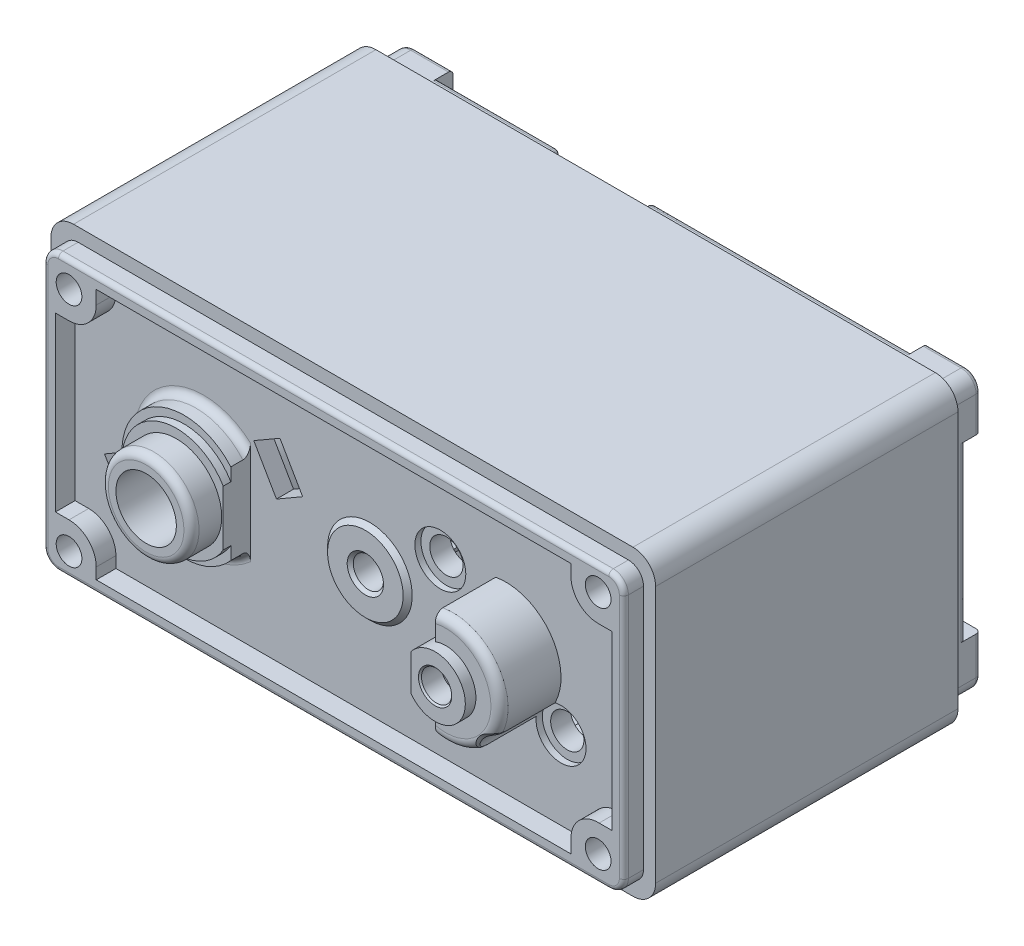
SolidWorks part; units mm, degrees
ref_plane "Front Plane" through (0, 0, 0) normal (0, 0, 1) x (1, 0, 0)
ref_plane "Top Plane" through (0, 0, 0) normal (0, 1, 0) x (1, 0, 0)
ref_plane "Right Plane" through (0, 0, 0) normal (1, 0, 0) x (0, 0, -1)
sketch "Sketch1" plane through (0, 0, 0) normal (0, 0, 1) x (1, 0, 0)
  line L0 (20, 10.083) -> (-20, 10.083)
  line L1 (-20, 10.083) -> (-20, -9.917)
  line L2 (20, -9.917) -> (20, 10.083)
  line L3 (20, -9.917) -> (-20, -9.917)
  line L4 (0, 10.083) -> (0, -13.0619) construction
  dimension "D1" = 40
  dimension "D2" = 20
  dimension "D3" = 10.083
extrude "Extrude1" add sketch "Sketch1" along normal blind 20
sketch "Sketch2" plane through (0, 0, 0) normal (0, 0, -1) x (-1, 0, 0)
  line L0 (-20, 10.083) -> (20, 10.083) construction
  line L1 (20, -9.917) -> (-20, -9.917) construction
  line L5 (-19.2, 9.2) -> (19.2, 9.2)
  line L6 (19.2, 9.2) -> (19.2, -9.037)
  line L8 (19.2, -9.037) -> (-19.2, -9.037)
  line L9 (-19.2, -9.037) -> (-19.2, 9.2)
  point P10 (0, 0)
  dimension "D1" = 19.2
  dimension "D2" = 0.883
  dimension "D3" = 19.2
  dimension "D4" = 0.88
extrude "Cut-Extrude1" cut sketch "Sketch2" against normal blind 18.87
fillet "Fillet1" radius 1 4 edges at (19.2, 9.2, 9.435) (19.2, -9.037, 9.435) (-19.2, -9.037, 9.435) (-19.2, 9.2, 9.435)
sketch "Sketch4" plane through (0, 0, 0) normal (0, 0, -1) x (-1, 0, 0)
  line L0 (19.2, 2.35) -> (18.4, 2.35)
  line L1 (19.2, -2.35) -> (18.4, -2.35)
  line L2 (19.2, -5.7) -> (18.4, -5.7)
  line L3 (15.7, -9.037) -> (15.7, -8.237)
  line L4 (7.5755, -9.037) -> (7.5755, -8.237)
  line L5 (0, 0) -> (0, 15.292) construction
  line L6 (19.2, 5.7) -> (18.4, 5.7)
  line L7 (15.7, 8.4) -> (15.7, 9.2)
  line L8 (-18.2, -9.037) -> (18.2, -9.037) construction
  line L31 (-15.7, 8.4) -> (1.6, 8.4)
  line L32 (-15.7, 9.2) -> (1.6, 9.2)
  line L33 (7.5755, 9.2) -> (15.7, 9.2)
  line L34 (7.5755, 8.4) -> (15.7, 8.4)
  line L35 (18.4, 5.7) -> (18.4, 2.35)
  line L36 (19.2, 5.7) -> (19.2, 2.35)
  line L37 (18.4, -2.35) -> (18.4, -5.7)
  line L38 (19.2, -2.35) -> (19.2, -5.7)
  line L39 (15.7, -9.037) -> (7.5755, -9.037)
  line L40 (15.7, -8.237) -> (7.5755, -8.237)
  line L41 (1.6, -9.037) -> (-15.7, -9.037)
  line L42 (1.6, -8.237) -> (-15.7, -8.237)
  line L43 (-18.4, -5.537) -> (-18.4, 5.863)
  line L44 (-19.2, -5.537) -> (-19.2, 5.863)
  line L45 (1.6, -9.037) -> (1.6, -8.237)
  line L46 (-15.7, -9.037) -> (-15.7, -8.237)
  line L47 (-18.4, -5.537) -> (-19.2, -5.537)
  line L48 (-18.4, 5.863) -> (-19.2, 5.863)
  line L49 (-15.7, 8.4) -> (-15.7, 9.2)
  line L50 (1.6, 8.4) -> (1.6, 9.2)
  line L51 (7.5755, 8.4) -> (7.5755, 9.2)
  point P8 (0, 0)
  dimension "D3" = 8.4
  dimension "D4" = 9.2
  dimension "D5" = 8.4
  dimension "D6" = 9.2
  dimension "D7" = 18.4
  dimension "D8" = 19.2
  dimension "D11" = 0.8
  dimension "D12" = 18.4
  dimension "D13" = 0.8
  dimension "D14" = 18.4
  dimension "D15" = 2.7
  dimension "D16" = 2.7
  dimension "D21" = 11.4
  dimension "D22" = 2.7
  dimension "D23" = 5.9755
  dimension "D24" = 17.3
  dimension "D25" = 8.1245
  dimension "D26" = 8.1245
  dimension "D27" = 3.35
  dimension "D28" = 3.35
  dimension "D29" = 4.7
  dimension "D32" = 17.3
  dimension "D33" = 2.7
ref_plane "Plane1" through (0, 0, 0) normal (0, 0, -1) x (-1, 0, 0)
extrude "Extrude3" add sketch "Sketch4" along normal blind 1.3
sketch "Sketch5" plane through (0, 0, -1.3) normal (0, 0, -1) x (-1, 0, 0)
  line L0 (-15.7, 8.4) -> (-15.7, 9.2) construction
  line L1 (1.6, 8.4) -> (1.6, 9.2) construction
  line L2 (-15.7, 9.2) -> (1.6, 9.2) construction
  line L3 (-15.7, 8.4) -> (1.6, 8.4) construction
  line L4 (-15.7, 8.4) -> (-15.7, 9.2)
  line L5 (1.6, 8.4) -> (1.6, 9.2)
  line L6 (-15.7, 9.2) -> (1.6, 9.2)
  line L7 (-15.7, 8.4) -> (1.6, 8.4)
  line L8 (7.5755, -9.037) -> (15.7, -9.037) construction
  line L9 (15.7, -9.037) -> (15.7, -8.237) construction
  line L10 (15.7, -8.237) -> (7.5755, -8.237) construction
  line L11 (7.5755, -9.037) -> (7.5755, -8.237) construction
  line L12 (1.6, -9.037) -> (1.6, -8.237) construction
  line L13 (-15.7, -9.037) -> (-15.7, -8.237) construction
  line L14 (1.6, -8.237) -> (-15.7, -8.237) construction
  line L15 (1.6, -9.037) -> (-15.7, -9.037) construction
  line L16 (7.5755, -9.037) -> (15.7, -9.037)
  line L17 (15.7, -9.037) -> (15.7, -8.237)
  line L18 (15.7, -8.237) -> (7.5755, -8.237)
  line L19 (7.5755, -9.037) -> (7.5755, -8.237)
  line L20 (1.6, -9.037) -> (1.6, -8.237)
  line L21 (-15.7, -9.037) -> (-15.7, -8.237)
  line L22 (1.6, -8.237) -> (-15.7, -8.237)
  line L23 (1.6, -9.037) -> (-15.7, -9.037)
  line L24 (-18.4, 5.863) -> (-19.2, 5.863) construction
  line L25 (-18.4, -5.537) -> (-19.2, -5.537) construction
  line L26 (-19.2, -5.537) -> (-19.2, 5.863) construction
  line L27 (-18.4, -5.537) -> (-18.4, 5.863) construction
  line L28 (-18.4, 5.863) -> (-19.2, 5.863)
  line L29 (-18.4, -5.537) -> (-19.2, -5.537)
  line L30 (-19.2, -5.537) -> (-19.2, 5.863)
  line L31 (-18.4, -5.537) -> (-18.4, 5.863)
  line L33 (19.2, 2.35) -> (19.2, 5.7) construction
  line L34 (19.2, 2.35) -> (18.4, 2.35) construction
  line L35 (18.4, 5.7) -> (18.4, 2.35) construction
  line L36 (19.2, -2.35) -> (18.4, -2.35) construction
  line L37 (19.2, -5.7) -> (18.4, -5.7) construction
  line L38 (19.2, -5.7) -> (19.2, -2.35) construction
  line L39 (18.4, -2.35) -> (18.4, -5.7) construction
  line L40 (18.4, 5.7) -> (19.2, 5.7)
  line L41 (19.2, 2.35) -> (19.2, 5.7)
  line L42 (19.2, 2.35) -> (18.4, 2.35)
  line L43 (18.4, 5.7) -> (18.4, 2.35)
  line L44 (19.2, -2.35) -> (18.4, -2.35)
  line L45 (19.2, -5.7) -> (18.4, -5.7)
  line L46 (19.2, -5.7) -> (19.2, -2.35)
  line L47 (18.4, -2.35) -> (18.4, -5.7)
  line L48 (15.7, 8.4) -> (15.7, 9.2) construction
  line L49 (7.5755, 8.4) -> (7.5755, 9.2) construction
  line L50 (15.7, 9.2) -> (7.5755, 9.2) construction
  line L51 (7.5755, 8.4) -> (15.7, 8.4) construction
  line L52 (15.7, 8.4) -> (15.7, 9.2)
  line L53 (7.5755, 8.4) -> (7.5755, 9.2)
  line L54 (15.7, 9.2) -> (7.5755, 9.2)
  line L55 (7.5755, 8.4) -> (15.7, 8.4)
extrude "Extrude4" add sketch "Sketch5" against normal up to vertex
sketch "Sketch6" plane through (0, 0, 0) normal (0, 0, -1) x (-1, 0, 0)
  line L0 (0, 0) -> (-27.3458, 0) construction
  line L1 (-19.2, -5.537) -> (-18.9613, -5.537)
  line L2 (-15.7, -7.336) -> (-15.7, -8.736)
  line L3 (-15.7, -8.736) -> (-15.7, -9.037)
  line L4 (-18.2, -9.037) -> (-15.7, -9.037) construction
  line L5 (-18.9613, -5.537) -> (-17.5613, -5.537)
  line L6 (-19.2, -5.537) -> (-19.2, -8.037) construction
  line L8 (0, 0) -> (0, 14.9831) construction
  line L9 (19.2, -5.7) -> (18.9, -5.7)
  line L10 (19.2, -5.7) -> (19.2, -8.037)
  line L11 (18.2, -9.037) -> (15.7, -9.037)
  line L12 (15.7, -9.037) -> (18.2, -9.037) construction
  line L13 (18.4, -5.7) -> (19.2, -5.7) construction
  line L14 (15.7, -9.037) -> (15.7, -8.237) construction
  line L15 (19.2, -8.037) -> (19.2, -5.7) construction
  line L16 (19.2, 5.7) -> (18.4, 5.7) construction
  line L17 (15.7, -8.9) -> (15.7, -9.037)
  line L18 (15.7, -7.5) -> (15.7, -8.9)
  line L19 (18.9, -5.7) -> (17.5, -5.7)
  line L20 (18.9, 5.7) -> (17.5, 5.7)
  line L21 (15.7, 7.5) -> (15.7, 8.9)
  line L22 (15.7, 8.9) -> (15.7, 9.2)
  line L23 (18.2, 9.2) -> (15.7, 9.2)
  line L24 (19.2, 5.7) -> (19.2, 8.2)
  line L25 (19.2, 5.7) -> (18.9, 5.7)
  line L26 (-18.4, 5.863) -> (-19.2, 5.863) construction
  line L27 (-15.7, 9.2) -> (-18.2, 9.2) construction
  line L28 (18.2, 9.2) -> (15.7, 9.2) construction
  line L29 (15.7, 8.4) -> (15.7, 9.2) construction
  line L30 (19.2, 5.7) -> (19.2, 8.2) construction
  line L33 (-18.2, -9.037) -> (-15.7, -9.037)
  line L34 (-19.2, -5.537) -> (-19.2, -8.037)
  line L44 (-19.2, 5.863) -> (-18.9, 5.863)
  line L45 (-19.2, 5.863) -> (-19.2, 8.2)
  line L46 (-18.2, 9.2) -> (-15.7, 9.2)
  line L47 (-15.7, 9.063) -> (-15.7, 9.2)
  line L48 (-15.7, 7.663) -> (-15.7, 9.063)
  line L49 (-18.9, 5.863) -> (-17.5, 5.863)
  arc A0 (-15.7, -7.336) -> (-17.5613, -5.537) centre (-17.5, -7.336) ccw
  arc A2 (-19.2, -8.037) -> (-18.2, -9.037) centre (-18.2, -8.037) ccw construction
  arc A5 (18.2, -9.037) -> (19.2, -8.037) centre (18.2, -8.037) ccw
  arc A6 (17.5, -5.7) -> (15.7, -7.5) centre (17.5, -7.5) ccw
  arc A9 (-18.2, 9.2) -> (-19.2, 8.2) centre (-18.2, 8.2) ccw
  arc A10 (-17.5, 5.863) -> (-15.7, 7.663) centre (-17.5, 7.663) ccw
  arc A11 (17.5, 5.7) -> (15.7, 7.5) centre (17.5, 7.5) cw
  arc A12 (18.2, 9.2) -> (19.2, 8.2) centre (18.2, 8.2) cw
  arc A13 (-19.2, -8.037) -> (-18.2, -9.037) centre (-18.2, -8.037) ccw
  point P26 (0, 0)
  dimension "D7" = 1
  dimension "D8" = 1.8
  dimension "D11" = 2.5
  dimension "D14" = 0.137
  dimension "D3" = 1.8
  dimension "D2" = 1.4
  dimension "D9" = 1.8
  dimension "D13" = 1
  dimension "D17" = 1.8
  dimension "D18" = 1
  dimension "D1" = 17.5
  dimension "D4" = 2.5
  dimension "D5" = 0.301
  dimension "D6" = 1.4
  dimension "D10" = 1.4
  dimension "D12" = 0.3
  dimension "D15" = 17.5
  dimension "D16" = 8.037
  dimension "D19" = 2.5
  dimension "D20" = 1.4
  dimension "D21" = 0.3
  dimension "D22" = 0.3
  dimension "D23" = 17.5
  dimension "D24" = 8.2
extrude "Extrude10" add sketch "Sketch6" against normal up to vertex
ref_plane "Plane2" through (0, 0, 0) normal (1, 0, 0) x (0, 0, -1)
ref_plane "Plane3" through (0, 0.083, 0) normal (0, -1, 0) x (1, 0, 0)
ref_plane "Plane4" through (0, 0, -0.5) normal (0, 0, -1) x (-1, 0, 0)
sketch "Sketch8" plane through (0, 0, -0.5) normal (0, 0, -1) x (-1, 0, 0)
  line L0 (7.5755, 8.4) -> (7.5755, 9.2) construction
  line L1 (1.6, 9.2) -> (7.5755, 9.2)
  line L2 (1.6, 9.2) -> (1.6, 8.7)
  line L3 (1.6, 8.7) -> (7.5755, 8.7)
  line L4 (7.5755, 9.2) -> (7.5755, 8.7)
  dimension "D1" = 0.5
extrude "Extrude12" add sketch "Sketch8" against normal up to vertex
sketch "Sketch9" plane through (0, 8.7, 0) normal (0, -1, 0) x (1, 0, 0)
  line L1 (-1.6, 8.78) -> (-7.5755, 8.78)
  line L2 (-1.6, 8.78) -> (-1.6, 18.87)
  line L3 (-1.6, 18.87) -> (-7.5755, 18.87)
  line L4 (-7.5755, 8.78) -> (-7.5755, 18.87)
  line L5 (-1.6, 18.87) -> (-7.5755, 18.87) construction
  line L6 (-7.5755, 18.87) -> (-7.5755, -0.5) construction
  line L7 (-1.6, 18.87) -> (-1.6, -0.5) construction
  dimension "D1" = 10.09
extrude "Extrude13" add sketch "Sketch9" along normal up to vertex
sketch "Sketch10" plane through (0, 0, -0.5) normal (0, 0, -1) x (-1, 0, 0)
  line L0 (1.6, -9.037) -> (7.5755, -9.037) construction
  line L1 (7.5755, -9.037) -> (1.6, -9.037)
  line L2 (7.5755, -9.037) -> (7.5755, -8.537)
  line L3 (7.5755, -8.537) -> (1.6, -8.537)
  line L4 (1.6, -9.037) -> (1.6, -8.537)
  line L5 (1.6, -9.037) -> (1.6, -8.237) construction
  line L6 (7.5755, -9.037) -> (7.5755, -8.237) construction
  dimension "D1" = 0.5
extrude "Extrude14" add sketch "Sketch10" against normal up to vertex
mirror "Mirror10" about plane through (0, 0.083, 0) normal (0, -1, 0) of "Extrude13"
sketch "Sketch12" plane through (0, 0, 0) normal (0, 0, -1) x (-1, 0, 0)
  line L0 (-15.7, -9.037) -> (-15.7, -8.237) construction
  line L1 (-15.7, -8.237) -> (-15.7, -7.336) construction
  line L2 (-18.4, -5.537) -> (-19.2, -5.537) construction
  line L3 (-17.5613, -5.537) -> (-18.4, -5.537) construction
  line L4 (-15.7, -9.037) -> (-15.7, -8.237)
  line L5 (-15.7, -8.237) -> (-15.7, -7.336)
  line L6 (-18.4, -5.537) -> (-19.2, -5.537)
  line L7 (-17.5613, -5.537) -> (-18.4, -5.537)
  line L8 (-15.7, -9.037) -> (-19.2, -9.037)
  line L9 (-19.2, -9.037) -> (-19.2, -5.537)
  line L10 (-19.2, 5.863) -> (-18.4, 5.863) construction
  line L11 (-18.4, 5.863) -> (-17.5, 5.863) construction
  line L12 (-15.7, 8.4) -> (-15.7, 9.2) construction
  line L13 (-15.7, 7.663) -> (-15.7, 8.4) construction
  line L14 (-19.2, 5.863) -> (-18.4, 5.863)
  line L15 (-18.4, 5.863) -> (-17.5, 5.863)
  line L16 (-15.7, 8.4) -> (-15.7, 9.2)
  line L17 (-15.7, 7.663) -> (-15.7, 8.4)
  line L18 (-15.7, 9.2) -> (-19.2, 9.2)
  line L19 (-19.2, 9.2) -> (-19.2, 5.863)
  line L20 (19.2, -5.7) -> (18.4, -5.7) construction
  line L21 (15.7, -9.037) -> (15.7, -8.237) construction
  line L22 (15.7, -7.5) -> (15.7, -8.237) construction
  line L23 (18.4, -5.7) -> (17.5, -5.7) construction
  line L24 (19.2, -5.7) -> (18.4, -5.7)
  line L25 (15.7, -9.037) -> (15.7, -8.237)
  line L26 (15.7, -7.5) -> (15.7, -8.237)
  line L27 (18.4, -5.7) -> (17.5, -5.7)
  line L28 (19.2, -5.7) -> (19.2, -9.037)
  line L29 (19.2, -9.037) -> (15.7, -9.037)
  line L30 (18.4, 5.7) -> (19.2, 5.7) construction
  line L31 (15.7, 8.4) -> (15.7, 9.2) construction
  line L32 (15.7, 8.4) -> (15.7, 7.5) construction
  line L33 (17.5, 5.7) -> (18.4, 5.7) construction
  line L34 (18.4, 5.7) -> (19.2, 5.7)
  line L35 (15.7, 8.4) -> (15.7, 9.2)
  line L36 (15.7, 8.4) -> (15.7, 7.5)
  line L37 (17.5, 5.7) -> (18.4, 5.7)
  line L38 (19.2, 5.7) -> (19.2, 9.2)
  line L39 (19.2, 9.2) -> (15.7, 9.2)
  arc A0 (-15.7, -7.336) -> (-17.5613, -5.537) centre (-17.5, -7.336) ccw construction
  arc A1 (-15.7, -7.336) -> (-17.5613, -5.537) centre (-17.5, -7.336) ccw
  arc A2 (-17.5, 5.863) -> (-15.7, 7.663) centre (-17.5, 7.663) ccw construction
  arc A3 (-17.5, 5.863) -> (-15.7, 7.663) centre (-17.5, 7.663) ccw
  arc A4 (17.5, -5.7) -> (15.7, -7.5) centre (17.5, -7.5) ccw construction
  arc A5 (17.5, -5.7) -> (15.7, -7.5) centre (17.5, -7.5) ccw
  arc A6 (15.7, 7.5) -> (17.5, 5.7) centre (17.5, 7.5) ccw construction
  arc A7 (15.7, 7.5) -> (17.5, 5.7) centre (17.5, 7.5) ccw
extrude "Extrude16" add sketch "Sketch12" along normal blind 2.3
sketch "Sketch13" plane through (0, 0, -2.3) normal (0, 0, -1) x (-1, 0, 0)
  circle A0 centre (-17.5, -7.336) radius 0.85
  arc A1 (-15.7, -7.336) -> (-17.5613, -5.537) centre (-17.5, -7.336) ccw construction
  circle A2 centre (-17.5, 7.663) radius 0.85
  arc A3 (-17.5, 5.863) -> (-15.7, 7.663) centre (-17.5, 7.663) ccw construction
  circle A4 centre (17.5, 7.5) radius 0.85
  circle A5 centre (17.5, -7.5) radius 0.85
  arc A6 (15.7, 7.5) -> (17.5, 5.7) centre (17.5, 7.5) ccw construction
  arc A7 (17.5, -5.7) -> (15.7, -7.5) centre (17.5, -7.5) ccw construction
  dimension "D1" = 1.7
extrude "Cut-Extrude2" cut sketch "Sketch13" against normal up to next
sketch "Sketch14" plane through (0, 0, 20) normal (0, 0, -1) x (-1, 0, 0)
  line L0 (15.7, -8.237) -> (7.5755, -8.237) construction
  line L1 (18.4, -2.35) -> (18.4, -5.7) construction
  line L2 (18.4, 5.7) -> (18.4, 2.35) construction
  line L3 (7.5755, 8.4) -> (15.7, 8.4) construction
  line L4 (-15.7, 8.4) -> (1.6, 8.4) construction
  line L5 (-18.4, -5.537) -> (-18.4, 5.863) construction
  line L6 (1.6, -8.237) -> (-15.7, -8.237) construction
  line L7 (-15.7, -9.037) -> (-15.7, -7.336) construction
  line L8 (-17.5613, -5.537) -> (-19.2, -5.537) construction
  line L9 (-19.2, -9.037) -> (-19.2, 9.2) construction
  line L10 (19.2, -5.7) -> (17.5, -5.7) construction
  line L11 (15.7, -7.5) -> (15.7, -9.037) construction
  line L12 (-19.2, -9.037) -> (19.2, -9.037) construction
  line L13 (19.2, -9.037) -> (19.2, -5.7) construction
  line L16 (19.2, 2.35) -> (19.2, 9.2) construction
  line L17 (17.5, 5.7) -> (19.2, 5.7) construction
  line L18 (15.7, 9.2) -> (15.7, 7.5) construction
  line L19 (19.2, 9.2) -> (15.7, 9.2) construction
  line L20 (19.2, 5.7) -> (19.2, 9.2) construction
  line L21 (19.2, 9.2) -> (-19.2, 9.2) construction
  line L22 (-15.7, 9.2) -> (-19.2, 9.2) construction
  line L23 (15.7, -8.237) -> (7.5755, -8.237)
  line L24 (18.4, -2.35) -> (18.4, -5.7)
  line L25 (18.4, 5.7) -> (18.4, 2.35)
  line L26 (7.5755, 8.4) -> (15.7, 8.4)
  line L27 (-15.7, 8.4) -> (1.6, 8.4)
  line L28 (-18.4, -5.537) -> (-18.4, 5.863)
  line L29 (1.6, -8.237) -> (-15.7, -8.237)
  line L30 (-15.7, -9.037) -> (-15.7, -7.336)
  line L31 (-17.5613, -5.537) -> (-19.2, -5.537)
  line L32 (-19.2, -9.037) -> (-19.2, 9.2)
  line L33 (19.2, -5.7) -> (17.5, -5.7)
  line L34 (15.7, -7.5) -> (15.7, -9.037)
  line L35 (-19.2, -9.037) -> (19.2, -9.037)
  line L36 (19.2, -9.037) -> (19.2, -5.7)
  line L37 (19.2, 2.35) -> (19.2, -5.7)
  line L38 (18.4, -2.35) -> (18.4, 2.35)
  line L39 (19.2, 2.35) -> (19.2, 9.2)
  line L40 (17.5, 5.7) -> (19.2, 5.7)
  line L41 (15.7, 9.2) -> (15.7, 7.5)
  line L42 (19.2, 9.2) -> (15.7, 9.2)
  line L43 (19.2, 5.7) -> (19.2, 9.2)
  line L44 (19.2, 9.2) -> (-19.2, 9.2)
  line L45 (-15.7, 9.2) -> (-19.2, 9.2)
  line L46 (-15.7, 7.663) -> (-15.7, 9.2) construction
  line L47 (-19.2, 5.863) -> (-17.5, 5.863) construction
  line L48 (-15.7, 7.663) -> (-15.7, 9.2)
  line L49 (-19.2, 5.863) -> (-17.5, 5.863)
  line L50 (7.5755, 8.4) -> (1.6, 8.4)
  line L51 (7.5755, -8.237) -> (1.6, -8.237)
  arc A0 (-15.7, -7.336) -> (-17.5613, -5.537) centre (-17.5, -7.336) ccw construction
  arc A1 (17.5, -5.7) -> (15.7, -7.5) centre (17.5, -7.5) ccw construction
  arc A2 (15.7, 7.5) -> (17.5, 5.7) centre (17.5, 7.5) ccw construction
  arc A3 (-15.7, -7.336) -> (-17.5613, -5.537) centre (-17.5, -7.336) ccw
  arc A4 (17.5, -5.7) -> (15.7, -7.5) centre (17.5, -7.5) ccw
  arc A5 (15.7, 7.5) -> (17.5, 5.7) centre (17.5, 7.5) ccw
  arc A6 (-17.5, 5.863) -> (-15.7, 7.663) centre (-17.5, 7.663) ccw construction
  arc A7 (-17.5, 5.863) -> (-15.7, 7.663) centre (-17.5, 7.663) ccw
  circle A8 centre (-17.5, 7.663) radius 0.85 construction
  circle A9 centre (-17.5, -7.336) radius 0.85 construction
  circle A10 centre (17.5, -7.5) radius 0.85 construction
  circle A11 centre (17.5, 7.5) radius 0.85 construction
  circle A12 centre (-17.5, 7.663) radius 0.85
  circle A13 centre (-17.5, -7.336) radius 0.85
  circle A14 centre (17.5, -7.5) radius 0.85
  circle A15 centre (17.5, 7.5) radius 0.85
extrude "Extrude17" add sketch "Sketch14" against normal blind 1.3 contours L40 A5 L41 L42 L39 M11 | L40 L39 L37 L33 L24 L38 L25 | L34 A4 L33 L36 L35 M10 | L29 L51 L23 L34 L35 L30 | L31 A3 L30 L35 L32 M13 | L49 L28 L31 L32 | L48 A7 L49 L32 L44 M12 | L50 L27 L48 L44 L41 L26
fillet "Fillet3" radius 0.3 4 edges at (19.2, 0.0815, 21.3) (0, -9.037, 21.3) (-19.2, 0.0815, 21.3) (0, 9.2, 21.3)
fillet "Fillet4" radius 1 8 edges at (-19.1121, -8.9492, 21.2121) (-19.1121, 9.1121, 21.2121) (19.1121, -8.9492, 21.2121) (19.1121, 9.1121, 21.2121) (19.2, 9.2, 20.5) (19.2, -9.037, 20.5) (-19.2, 9.2, 20.5) (-19.2, -9.037, 20.5)
fillet "Fillet5" radius 0.3 7 edges at (-11.6378, 9.2, -1.3) (-19.2, 4.025, -1.3) (-19.2, -4.025, -1.3) (-11.6378, -9.037, -1.3) (7.05, 9.2, -1.3) (19.2, 0.163, -1.3) (7.05, -9.037, -1.3)
fillet "Fillet6" radius 1.5 4 edges at (-20, 10.083, 10) (20, 10.083, 10) (-20, -9.917, 10) (20, -9.917, 10)
ref_plane "Plane5" through (0, 0, 8.27) normal (0, 0, -1) x (-1, 0, 0)
sketch "Sketch16" plane through (0, 0, 8.27) normal (0, 0, -1) x (-1, 0, 0)
  line L0 (-6.75, 8.4) -> (-5.45, 8.4)
  line L1 (0, 8.4) -> (1.3856, 8.4)
  line L2 (0, -8.4) -> (1.3856, -8.4)
  line L3 (-6.7974, -8.4) -> (-5.3852, -8.4)
  line L10 (-5.45, 8.02) -> (-5.45, 8.4)
  line L11 (-6.75, 8.4) -> (-6.75, 7.7389)
  line L12 (-6.75, 7.7389) -> (-6.75, 7.2)
  line L13 (0, 8.4) -> (-2.0499, 4.8495)
  line L14 (1.3856, 8.4) -> (-1.3895, 3.5933)
  line L15 (-2.5164, -1.6415) -> (-0.9074, 2.149)
  line L16 (-2.5164, -1.6415) -> (1.3856, -8.4)
  line L17 (-3.1035, -3.0247) -> (0, -8.4)
  line L18 (-5.3852, -8.4) -> (-3.1035, -3.0247)
  line L19 (-6.7974, -8.4) -> (-2.2796, 2.2434)
  arc A3 (-2.0499, 4.8495) -> (-5.45, 8.02) centre (-9.75, 0) ccw
  arc A4 (-2.2796, 2.2434) -> (-6.75, 7.2) centre (-9.75, 0) ccw
  arc A5 (-0.9074, 2.149) -> (-1.3895, 3.5933) centre (-9.75, 0) ccw
  point P18 (0, 0)
  dimension "D4" = 7.8
  dimension "D8" = 9.1
  dimension "D21" = 9.1
  dimension "D1" = 1.3
  dimension "D2" = 2.5164
  dimension "D3" = 1.2
  dimension "D5" = 9.75
  dimension "D6" = 5.5503
  dimension "D7" = 1.2
  dimension "D9" = 1.3
  dimension "D10" = 0.5389
  dimension "D11" = 0.6611
  dimension "D12" = 4.0997
  dimension "D13" = 11.5626
  dimension "D14" = 4.1179
  dimension "D15" = 5.8396
  dimension "D16" = 53
  dimension "D17" = 7.804
  dimension "D18" = 1.3754
  dimension "D19" = 4.9566
  dimension "D20" = 1.4443
  dimension "D22" = 3.1704
  dimension "D23" = 0.82
  dimension "D24" = 0.38
  dimension "D25" = 16.8
  dimension "D26" = 8.1831
  dimension "D27" = 8.1356
extrude "Extrude18" add sketch "Sketch16" against normal up to vertex
sketch "Sketch18" plane through (0, 0, 18.87) normal (0, 0, -1) x (-1, 0, 0)
  line L0 (-2.5164, -1.6415) -> (-0.9074, 2.149) construction
  arc A4 (-2.3614, 2.4998) -> (-3.6868, -1.0717) centre (-1.1, 0) ccw
  arc A6 (-3.6868, -1.0717) -> (-2.3614, 2.4998) centre (-1.1, 0) ccw
  point P3 (0, 0)
  dimension "D1" = 1.1
  dimension "D2" = 2.8
  dimension "D3" = 0.6624
extrude "Extrude19" add sketch "Sketch18" along normal blind 0.6
chamfer "Chamfer1" distance 0.2 angle 45 1 edges at (-1.6687, -0.4178, 18.27)
sketch "Sketch19" plane through (0, 0, 18.87) normal (0, 0, -1) x (-1, 0, 0)
  line L0 (-18.4, 0) -> (-18.4, -1.3)
  line L1 (-14.1148, 8.4) -> (-12.7026, 8.4)
  line L6 (-17.6804, 0) -> (-18.4, 0)
  line L7 (-18.4, -1.3) -> (-17.3632, -1.3)
  line L8 (-16.82, -1.3) -> (-17.3632, -1.3)
  line L9 (-12.7026, 8.4) -> (-16.82, -1.3)
  line L10 (-17.6804, 0) -> (-14.1148, 8.4)
  point P3 (0, 0)
  dimension "D1" = 9.7
  dimension "D2" = 8.4
  dimension "D3" = 1.3
  dimension "D4" = 0.7196
  dimension "D5" = 1.0368
  dimension "D6" = 1.3
  dimension "D7" = 18.4
  dimension "D8" = 12.7026
  dimension "D9" = 8.4
extrude "Extrude20" add sketch "Sketch19" along normal blind 10.6
chamfer "Chamfer2" distance 0.7 angle 45 1 edges at (14.7613, 3.55, 8.27)
sketch "Sketch20" plane through (0, 0, 18.87) normal (0, 0, -1) x (-1, 0, 0)
  line L1 (-18.4, -2.5) -> (-18.4, -3.8)
  line L15 (-15.7112, -7.2996) -> (-15.4764, -7.0724)
  line L16 (-14.05, -8.02) -> (-14.05, -8.4)
  line L17 (-14.05, -8.4) -> (-12.75, -8.4)
  line L18 (-12.75, -8.4) -> (-12.75, -7.7389)
  line L19 (-12.75, -7.7389) -> (-12.75, -7.2)
  line L20 (-17.1385, -2.5) -> (-17.6645, -2.5)
  line L21 (-17.6645, -2.5) -> (-18.4, -2.5)
  line L22 (-18.4, -3.8) -> (-18.0186, -3.8)
  line L23 (-17.2411, -5.7187) -> (-17.0063, -5.4915)
  arc A8 (-15.4764, -7.0724) -> (-14.05, -8.02) centre (-9.75, 0) ccw
  arc A9 (-17.1385, -2.5) -> (-12.75, -7.2) centre (-9.75, 0) ccw
  arc A10 (-18.0186, -3.8) -> (-17.0063, -5.4915) centre (-9.75, 0) ccw
  arc A11 (-15.7112, -7.2996) -> (-17.2411, -5.7187) centre (-17.5, -7.5) ccw
  point P18 (0, 0)
  dimension "D2" = 1.8
  dimension "D3" = 9.75
  dimension "D4" = 17.5
  dimension "D11" = 2.2
  dimension "D6" = 18.4
  dimension "D20" = 19.0394
  dimension "D21" = 9.1
  dimension "D5" = 1.3
  dimension "D7" = 1.3
  dimension "D8" = 0.7355
  dimension "D9" = 1.2
  dimension "D10" = 0.38
  dimension "D12" = 0.3268
  dimension "D13" = 1.9187
  dimension "D14" = 5.9
  dimension "D15" = 5.65
  dimension "D16" = 0.526
  dimension "D17" = 0.6611
  dimension "D18" = 2.2241
  dimension "D19" = 8.4
extrude "Extrude21" add sketch "Sketch20" along normal blind 10.6
ref_plane "Plane7" through (10.1, 0, 0) normal (1, 0, 0) x (0, 0, -1)
sketch "Sketch21" plane through (10.1, 0, 0) normal (-1, 0, 0) x (0, 0, 1)
  line L0 (22.7866, -1.5677) -> (22.7866, 0.2424)
  line L1 (21.3, -8.237) -> (20, -8.237) construction
  line L2 (20, -7.336) -> (20, -5.536) construction
  line L3 (24.6866, 0.2424) -> (20.4639, 0.2424) construction
  line L5 (22.7866, 0.2424) -> (24.6866, 0.2424)
  line L10 (24.6866, -1.7576) -> (24.6866, 0.2424)
  line L12 (22.7866, -1.5677) -> (22.7866, -2.4576)
  line L13 (20, -2.4576) -> (20, -3.3993)
  line L14 (22.7866, -2.4576) -> (20, -2.4576)
  line L15 (23.5, -3.3993) -> (20, -3.3993)
  line L16 (23.9866, -1.7576) -> (23.9866, -2.7507)
  line L17 (23.9866, -1.7576) -> (24.6866, -1.7576)
  spline S1 degree 3 poles (23.5, -3.3993) (23.6504, -3.3812) (23.7887, -3.2975) (23.9656, -3.0565) (24.0047, -2.9009) (23.9866, -2.7507) knots 0 0 0 0 0.5 0.5 1 1 1 1
  point P3 (0, 0)
  point P5 (0, 0)
  point P11 (0, 0)
  dimension "D2" = 4.8377
  dimension "D3" = 0.9417
  dimension "D4" = 2.7
  dimension "D5" = 0.8899
  dimension "D6" = 3.5
  dimension "D7" = 2
  dimension "D8" = 0.993
  dimension "D9" = 2.7866
  dimension "D10" = 0.7
  dimension "D11" = 1.2
revolve "Revolve1" add sketch "Sketch21" angle 360 about L3
ref_plane "Plane11" through (0, 0, 24.0866) normal (0, 0, 1) x (1, 0, 0)
sketch "Sketch22" plane through (0, 0, 24.6866) normal (0, 0, 1) x (1, 0, 0)
  line L0 (8.5, 1.4424) -> (8.5, -0.9576)
  line L1 (9.42, 3.1572) -> (9.42, 2.1232)
  line L2 (9.42, -1.6385) -> (9.42, -2.6724)
  circle A0 centre (10.1, 0.2424) radius 2 construction
  circle A2 centre (10.1, 0.2424) radius 2 construction
  arc A17 (9.42, 2.1232) -> (8.5, 1.4424) centre (10.1, 0.2424) ccw
  arc A18 (8.5, -0.9576) -> (9.42, -1.6385) centre (10.1, 0.2424) ccw
  arc A19 (9.42, 3.1572) -> (9.42, -2.6724) centre (10.1, 0.2424) ccw
  circle A20 centre (10.1, 0.2424) radius 2.993 construction
  point P12 (0, 0)
  dimension "D1" = 1.6
  dimension "D3" = 0.92
extrude "Cut-Extrude3" cut sketch "Sketch22" against normal blind 10.6
sketch "Sketch24" plane through (0, 0, 20) normal (0, 0, 1) x (1, 0, 0)
  line L0 (9.42, 2.8554) -> (9.42, 2.1232) construction
  line L1 (8.5, 1.4424) -> (8.5, -0.9576) construction
  line L2 (9.42, -1.6385) -> (9.42, -2.3706) construction
  line L3 (9.42, 2.8554) -> (9.42, 2.1232)
  line L4 (8.5, 1.4424) -> (8.5, -0.9576)
  line L5 (9.42, -1.6385) -> (9.42, -2.3706)
  arc A0 (9.42, 2.1232) -> (8.5, 1.4424) centre (10.1, 0.2424) ccw construction
  arc A1 (9.42, -2.3706) -> (9.42, 2.8554) centre (10.1, 0.2424) ccw construction
  arc A2 (8.5, -0.9576) -> (9.42, -1.6385) centre (10.1, 0.2424) ccw construction
  arc A3 (9.42, 2.1232) -> (8.5, 1.4424) centre (10.1, 0.2424) ccw
  arc A4 (9.42, -2.3706) -> (9.42, 2.8554) centre (10.1, 0.2424) ccw
  arc A5 (8.5, -0.9576) -> (9.42, -1.6385) centre (10.1, 0.2424) ccw
extrude "Cut-Extrude4" cut sketch "Sketch24" against normal up to vertex
sketch "Sketch25" plane through (0, 0, 24.6866) normal (0, 0, 1) x (1, 0, 0)
  circle A0 centre (10.1, 0.2424) radius 1
  circle A1 centre (10.1, 0.2424) radius 2 construction
  dimension "D1" = 2
extrude "Cut-Extrude5" cut sketch "Sketch25" against normal blind 1.4
chamfer "Chamfer3" distance 0.1 angle 45 1 edges at (11.1, 0.2424, 24.6866)
sketch "Sketch26" plane through (0, 0, 23.9866) normal (0, 0, 1) x (1, 0, 0)
  arc A7 (12.0966, -3.1151) -> (13.5362, -1.3721) centre (13.7432, -3.0091) ccw
  arc A8 (13.5362, -1.3721) -> (12.0966, -3.1151) centre (13.7432, -3.0091) ccw
  point P12 (0, 0)
  dimension "D1" = 1.65
  dimension "D2" = 13.7432
  dimension "D3" = 3.0091
  dimension "D4" = 1.743
extrude "Cut-Extrude6" cut sketch "Sketch26" against normal blind 4.4
chamfer "Chamfer4" distance 0.1 angle 45 1 edges at (12.4854, -1.9412, 23.9674)
sketch "Sketch27" plane through (0, 0, 19.5866) normal (0, 0, 1) x (1, 0, 0)
  circle A0 centre (13.7432, -3.0091) radius 1.1
  circle A1 centre (13.7432, -3.0091) radius 1.65 construction
  dimension "D1" = 2.2
extrude "Cut-Extrude7" cut sketch "Sketch27" against normal blind 4.4
sketch "Sketch28" plane through (0, 0, 20) normal (0, 0, 1) x (1, 0, 0)
  line L0 (15.7, 8.4) -> (-15.7, 8.4) construction
  circle A0 centre (5.76, 3.01) radius 1.6845
  circle A1 centre (10.1, 0.2424) radius 2 construction
  dimension "D2" = 4.34
  dimension "D1" = 5.39
sketch "Sketch29" plane through (0, 0, 24.0866) normal (0, 0, 1) x (1, 0, 0)
  line L0 (9.42, 3.1572) -> (9.42, 3.82)
  line L1 (9.42, -2.6724) -> (9.42, -3.3353)
  arc A0 (13.3466, -1.4075) -> (12.1069, -2.7964) centre (10.1, 0.2424) ccw construction
  circle A1 centre (10.1, 0.2424) radius 3.6417 construction
  arc A2 (9.42, 3.1572) -> (9.42, -2.6724) centre (10.1, 0.2424) ccw
  arc A3 (9.42, 3.82) -> (9.42, -3.3353) centre (10.1, 0.2424) ccw
  circle A4 centre (10.1, 0.2424) radius 2.993 construction
  circle A5 centre (10.1, 0.2424) radius 2.993 construction
extrude "Cut-Extrude12" cut sketch "Sketch29" against normal up to vertex
extrude "Cut-Extrude13" cut sketch "Sketch28" against normal blind 0.4
sketch "Sketch30" plane through (0, 0, 19.6) normal (0, 0, 1) x (1, 0, 0)
  circle A0 centre (5.76, 3.01) radius 1.1
  circle A1 centre (5.76, 3.01) radius 1.6845 construction
  dimension "D1" = 2.2
extrude "Cut-Extrude14" cut sketch "Sketch30" against normal blind 10.4
sketch "Sketch31" plane through (0, 0, 20) normal (0, 0, 1) x (1, 0, 0)
  line L0 (9.42, -2.6724) -> (9.42, -2.3706)
  line L1 (9.42, 3.1572) -> (9.42, 2.8554)
  arc A0 (9.42, 3.1572) -> (9.42, -2.6724) centre (10.1, 0.2424) ccw construction
  arc A1 (9.42, 3.1572) -> (9.42, -2.6724) centre (10.1, 0.2424) ccw
  arc A2 (9.42, 2.8554) -> (9.42, -2.3706) centre (10.1, 0.2424) ccw
  dimension "D1" = 5.4
extrude "Extrude22" add sketch "Sketch31" against normal up to vertex
sketch "Sketch32" plane through (0, 0, 18.87) normal (0, 0, -1) x (-1, 0, 0)
  arc A0 (-7.7706, 3.6164) -> (-14.0292, -0.9286) centre (-10.1, 0.2424) ccw
  circle A2 centre (-10.1, 0.2424) radius 2.7 construction
  arc A3 (-6.0583, 0.9313) -> (-7.7706, 3.6164) centre (-5.76, 3.01) ccw
  arc A4 (-14.0292, -0.9286) -> (-11.7085, -3.5289) centre (-13.7432, -3.0091) ccw
  arc A6 (-11.7085, -3.5289) -> (-6.0583, 0.9313) centre (-10.1, 0.2424) ccw
  circle A7 centre (-10.1, 0.2424) radius 2.7
  circle A8 centre (-5.76, 3.01) radius 1.1 construction
  circle A9 centre (-5.76, 3.01) radius 1.1
  circle A10 centre (-13.7432, -3.0091) radius 1.1 construction
  circle A11 centre (-13.7432, -3.0091) radius 1.1
  dimension "D1" = 8.2
  dimension "D2" = 4.2
  dimension "D3" = 4.2
extrude "Extrude23" add sketch "Sketch32" along normal blind 0.6
sketch "Sketch33" plane through (0, 0, 20) normal (0, 0, 1) x (1, 0, 0)
  circle A2 centre (1.1, 0) radius 2.8
  point P0 (0, 0)
  dimension "D1" = 5.6
  dimension "D2" = 1.1
extrude "Extrude24" add sketch "Sketch33" along normal blind 0.3
chamfer "Chamfer5" distance 0.3 angle 45 1 edges at (3.9, 0, 20.3)
sketch "Sketch34" plane through (0, 0, 20.3) normal (0, 0, 1) x (1, 0, 0)
  circle A0 centre (1.1, 0) radius 1
  circle A1 centre (1.1, 0) radius 2.5 construction
  dimension "D1" = 2
extrude "Cut-Extrude15" cut sketch "Sketch34" against normal blind 1.7
chamfer "Chamfer6" distance 0.2 angle 45 1 edges at (2.1, 0, 20.3)
sketch "Sketch35" plane through (0, 0, 20) normal (0, 0, 1) x (1, 0, 0)
  circle A0 centre (-9.9002, 0) radius 4.1
  arc A7 (-9.7861, 4.0984) -> (-13.9885, -0.3085) centre (-9.9002, 0) ccw
  point P9 (0, 0)
  dimension "D1" = 4.1
  dimension "D3" = 8.2
  dimension "D2" = 9.9002
extrude "Extrude25" add sketch "Sketch35" along normal blind 1.3 contours A0
fillet "Fillet7" radius 0.5 1 edges at (-14.0002, 0, 20)
sketch "Sketch36" plane through (0, 0, 21.3) normal (0, 0, 1) x (1, 0, 0)
  circle A0 centre (-9.9002, 0) radius 3.6
  circle A1 centre (-9.9002, 0) radius 4.1 construction
  dimension "D1" = 7.2
extrude "Extrude26" add sketch "Sketch36" along normal blind 0.5
sketch "Sketch37" plane through (0, 0, 21.8) normal (0, 0, 1) x (1, 0, 0)
  circle A0 centre (-9.9002, 0) radius 3
  circle A1 centre (-9.9002, 0) radius 3.6 construction
  dimension "D1" = 6
extrude "Extrude27" add sketch "Sketch37" along normal blind 2
fillet "Fillet8" radius 0.5 1 edges at (-6.9002, 0, 23.8)
sketch "Sketch38" plane through (0, 0, 23.8) normal (0, 0, 1) x (1, 0, 0)
  circle A0 centre (-9.9002, 0) radius 2
  circle A1 centre (-9.9002, 0) radius 2.5 construction
  dimension "D1" = 4
extrude "Cut-Extrude16" cut sketch "Sketch38" against normal up to vertex
sketch "Sketch39" plane through (0, 0, 23.8) normal (0, 0, 1) x (1, 0, 0)
  line L0 (-6.8, 3.3984) -> (-6.8, -3.3984)
  arc A1 (-6.8, -3.3984) -> (-6.8, 3.3984) centre (-9.9002, 0) ccw
  circle A2 centre (-9.9002, 0) radius 4.6 construction
  dimension "D1" = 6.8
extrude "Cut-Extrude17" cut sketch "Sketch39" against normal up to vertex
sketch "Sketch40" plane through (0, 0, 20) normal (0, 0, 1) x (1, 0, 0)
  line L5 (-5.0797, 1.051) -> (-3.3476, 2.051)
  line L6 (-4.8476, 4.649) -> (-3.3476, 2.051)
  line L7 (-4.8476, 4.649) -> (-6.5797, 3.649)
  line L8 (-6.5797, 3.649) -> (-5.0797, 1.051)
  line L13 (-13.2203, -3.649) -> (-14.7203, -1.051)
  line L14 (-14.9524, -4.649) -> (-13.2203, -3.649)
  line L15 (-14.9524, -4.649) -> (-16.4524, -2.051)
  line L16 (-14.7203, -1.051) -> (-16.4524, -2.051)
  point P9 (0, 0)
  dimension "D1" = 9.4
  dimension "D2" = 5.0797
  dimension "D3" = 14.9524
  dimension "D4" = 4.649
  dimension "D5" = 2.051
  dimension "D6" = 3.3476
  dimension "D7" = 4.8476
  dimension "D8" = 3.649
  dimension "D9" = 3
  dimension "D10" = 2
  dimension "D11" = 13.2203
extrude "Cut-Extrude18" cut sketch "Sketch40" against normal up to vertex
sketch "Sketch41" plane through (0, 0, 18.87) normal (0, 0, -1) x (-1, 0, 0)
  arc A17 (12.2898, -7.4249) -> (12.2922, -7.4241) centre (9.9, 0) ccw
  arc A18 (12.2922, -7.4241) -> (12.1322, -7.4738) centre (9.9, 0) ccw
  arc A19 (12.1322, -7.4738) -> (11.9831, -7.5167) centre (9.9, 0) ccw
  arc A20 (8.1008, -7.5897) -> (8.2295, -7.619) centre (9.9, 0) ccw
  arc A21 (8.2295, -7.619) -> (8.6078, -7.6922) centre (9.9, 0) ccw
  arc A22 (8.6078, -7.6922) -> (8.7946, -7.7213) centre (9.9, 0) ccw
  arc A23 (10.1964, -4.0893) -> (9.6268, -4.0909) centre (9.9, 0) ccw
  arc A24 (9.6268, -4.0909) -> (10.1964, -4.0893) centre (9.9, 0) ccw
  arc A25 (8.7946, -7.7213) -> (12.2898, -7.4249) centre (9.9, 0) ccw
  arc A26 (8.58, -6.4667) -> (11.3215, -6.4451) centre (9.9, 0) ccw
  arc A27 (11.3215, -6.4451) -> (8.58, -6.4667) centre (9.9, 0) ccw
  arc A28 (11.9831, -7.5167) -> (8.1008, -7.5897) centre (9.9, 0) ccw
  point P3 (0, 0)
  dimension "D1" = 7.8
  dimension "D2" = 6.6
  dimension "D4" = 4.1
  dimension "D3" = 9.9
extrude "Extrude28" add sketch "Sketch41" along normal blind 5.9 contours A19 A17 A18 A27 A26 M25 M32 M29 M30 M27 M28 | A24 A23 M33
sketch "Sketch42" plane through (0, 0, 12.97) normal (0, 0, -1) x (-1, 0, 0)
  circle A0 centre (9.9002, 0) radius 2.8
  circle A1 centre (9.9002, 0) radius 2 construction
  circle A2 centre (9.9002, 0) radius 2
  dimension "D1" = 5.6
extrude "Cut-Extrude19" cut sketch "Sketch42" against normal blind 4.3
chamfer "Chamfer7" distance 0.5 angle 45 1 edges at (-12.7002, 0, 12.97)
fillet "Fillet9" radius 0.5 1 edges at (-12.7002, 0, 17.27)
sketch "Sketch43" plane through (0, 0, 18.87) normal (0, 0, -1) x (-1, 0, 0)
  line L0 (10.95, 3.9631) -> (10.95, 6.5158)
  line L13 (7.7, 3.4595) -> (7.7, 6.2223)
  line L14 (8.9, 3.976) -> (8.9, 6.5236)
  line L15 (12.15, 6.2045) -> (12.15, 3.4274)
  arc A1 (8.9, 6.5236) -> (7.7, 6.2223) centre (9.9002, 0) ccw
  arc A2 (12.15, 3.4274) -> (10.95, 3.9631) centre (9.9002, 0) ccw
  arc A3 (8.9, 3.976) -> (7.7, 3.4595) centre (9.9002, 0) ccw
  arc A4 (12.15, 6.2045) -> (10.95, 6.5158) centre (9.9002, 0) ccw
  point P5 (0, 0)
  dimension "D6" = 13.1997
  dimension "D4" = 8.1997
  dimension "D1" = 12.15
  dimension "D2" = 7.7
  dimension "D3" = 1.2
  dimension "D5" = 1.2
extrude "Extrude34" add sketch "Sketch43" along normal blind 2.8
chamfer "Chamfer8" distance 0.8 angle 45 2 edges at (-7.7, 4.841, 16.07) (-12.15, 4.816, 16.07)
ref_plane "Plane9" through (-1.875, 3.2476, 0) normal (-0.5, 0.866, 0) x (-0.866, -0.5, 0)
sketch "Sketch46" plane through (-1.875, 3.2476, 0) normal (-0.5, 0.866, 0) x (-0.866, -0.5, 0)
  line L0 (1.8737, 15.47) -> (1.8737, 11.47)
  line L1 (1.8737, 11.47) -> (2.7665, 11.47)
  line L2 (2.7665, 11.47) -> (2.7665, 9.97)
  line L3 (2.7665, 9.97) -> (0.8665, 9.97)
  line L4 (0.8665, 9.97) -> (0.8665, 15.47)
  line L5 (0.7737, 12.97) -> (16.3737, 12.97) construction
  line L6 (1.8737, 12.97) -> (1.8737, 20) construction
  line L8 (0.8665, 15.47) -> (1.8737, 15.47)
  dimension "D1" = 5.5
  dimension "D2" = 4
  dimension "D3" = 1.9
  dimension "D4" = 1.0071
  dimension "D5" = 2.5
extrude "Extrude35" add sketch "Sketch46" along normal blind 2.4
chamfer "Chamfer9" distance 1.1 angle 45 1 edges at (-4.8709, 2.9036, 9.97)
ref_plane "Plane10" through (-7.425, -4.2868, 0) normal (-0.866, -0.5, 0) x (0, 0, 1)
mirror "Mirror11" about plane through (-7.425, -4.2868, 0) normal (-0.866, -0.5, 0) of "Chamfer9", "Extrude35"
sketch "Sketch48" plane through (0, 0, 9.97) normal (0, 0, -1) x (-1, 0, 0)
  line L1 (2.6254, 2.8143) -> (3.8254, 4.8928) construction
  line L2 (2.6254, 2.8143) -> (3.8254, 4.8928)
  arc A1 (3.8254, 4.8928) -> (2.6254, 2.8143) centre (9.9, 0) ccw construction
  arc A7 (3.8254, 4.8928) -> (2.6254, 2.8143) centre (9.9, 0) ccw
extrude "Extrude36" add sketch "Sketch48" against normal up to surface (8.9 mm away)
sketch "Sketch49" plane through (0, 0, 9.97) normal (0, 0, -1) x (-1, 0, 0)
  line L1 (15.9746, -4.8928) -> (17.1746, -2.8143) construction
  line L2 (15.9746, -4.8928) -> (17.1746, -2.8143)
  arc A1 (15.9746, -4.8928) -> (17.1746, -2.8143) centre (9.9, 0) ccw construction
  arc A2 (15.9746, -4.8928) -> (17.1746, -2.8143) centre (9.9, 0) ccw
extrude "Extrude37" add sketch "Sketch49" against normal up to surface (8.9 mm away)
sketch "Sketch50" plane through (0, 0, 18.87) normal (0, 0, -1) x (-1, 0, 0)
  line L0 (-5.4662, -5.2638) -> (-5.6235, -4.8744)
  line L1 (-3.6868, -1.0717) -> (-6.7282, -8.237) construction
  line L2 (-5.6235, -4.8744) -> (-5.2341, -4.717)
  line L3 (-5.2341, -4.717) -> (-5.4662, -5.2638)
  line L4 (-5.6235, -4.8744) -> (-5.3501, -4.9904) construction
  dimension "D1" = 3.23
  dimension "D2" = 0.42
  dimension "D3" = 0.42
extrude "Extrude38" add sketch "Sketch50" along normal blind 8
sketch "Sketch52" plane through (0, 0, 18.27) normal (0, 0, -1) x (-1, 0, 0)
  line L0 (-3.1124, 0.2813) -> (-2.8819, 0.8244)
  line L1 (-3.6868, -1.0717) -> (-2.2796, 2.2434) construction
  line L2 (-2.8819, 0.8244) -> (-3.2724, 0.6697)
  line L3 (-3.2724, 0.6697) -> (-3.1124, 0.2813)
  line L5 (-5.2341, -4.717) -> (-5.6235, -4.8744) construction
  line L6 (-5.6235, -4.8744) -> (-5.4662, -5.2638) construction
  dimension "D1" = 5.43
  dimension "D2" = 0.59
extrude "Extrude39" add sketch "Sketch52" along normal blind 7.4
sketch "Sketch54" plane through (0, 0, 18.87) normal (0, 0, -1) x (-1, 0, 0)
  line L0 (-12.7026, 8.4) -> (-6.75, 8.4) construction
  line L1 (-10.4526, 8.4) -> (-9.0726, 8.4)
  line L2 (-10.4526, 8.4) -> (-10.4526, 7.8)
  line L3 (-10.4526, 7.8) -> (-9.0726, 7.8)
  line L4 (-9.0726, 8.4) -> (-9.0726, 7.8)
  line L5 (-6.7282, -8.237) -> (-12.75, -8.237) construction
  line L6 (-10.45, -8.237) -> (-9.07, -8.237)
  line L7 (-10.45, -8.237) -> (-10.45, -7.637)
  line L8 (-10.45, -7.637) -> (-9.07, -7.637)
  line L9 (-9.07, -8.237) -> (-9.07, -7.637)
  line L10 (-12.75, -8.237) -> (-12.75, -7.2) construction
  dimension "D1" = 2.3
  dimension "D2" = 1.38
  dimension "D3" = 0.6
  dimension "D4" = 1.38
  dimension "D5" = 0.6
  dimension "D6" = 2.25
extrude "Extrude40" add sketch "Sketch54" along normal blind 10.6
chamfer "Chamfer10" distance 0.5 angle 45 2 edges at (9.7626, 7.8, 8.27) (9.76, -7.637, 8.27)
fillet "Fillet10" radius 0.3 20 edges at (17.45, -9.037, -2.3) (19.2, -7.287, -2.3) (-17.45, -9.037, -2.3) (-19.2, -7.3685, -2.3) (-19.2, 7.45, -2.3) (-17.45, 9.2, -2.3) (17.45, 9.2, -2.3) (19.2, 7.5315, -2.3) (-1.6, 8.65, -1.3) (-1.6, 9.1121, -1.2121) (-7.5755, 8.65, -1.3) (-7.5755, 9.1121, -1.2121) (-1.6, -8.487, -1.3) (-1.6, -8.9492, -1.2121) (-7.5755, -8.487, -1.3) (-7.5755, -8.9492, -1.2121) (-1.6, 9.2, -0.75)
fillet "Fillet11" radius 1 8 edges at (19.1121, -8.9492, -2.2121) (19.2, -9.037, -1) (19.1121, 9.1121, -2.2121) (-19.1121, 9.1121, -2.2121) (-19.1121, -8.9492, -2.2121) (-19.2, -9.037, -1) (-19.2, 9.2, -1) (19.2, 9.2, -1)
sketch "Sketch55" plane through (0, 0, 0) normal (0, 0, -1) x (-1, 0, 0)
  line L1 (19.2, 2.35) -> (18.4, 2.35)
  line L2 (19.2, 2.35) -> (19.2, -2.35)
  line L3 (19.2, -2.35) -> (18.4, -2.35)
  line L4 (18.4, 2.35) -> (18.4, -2.35)
extrude "Extrude41" add sketch "Sketch55" against normal up to surface (18.87 mm away)
